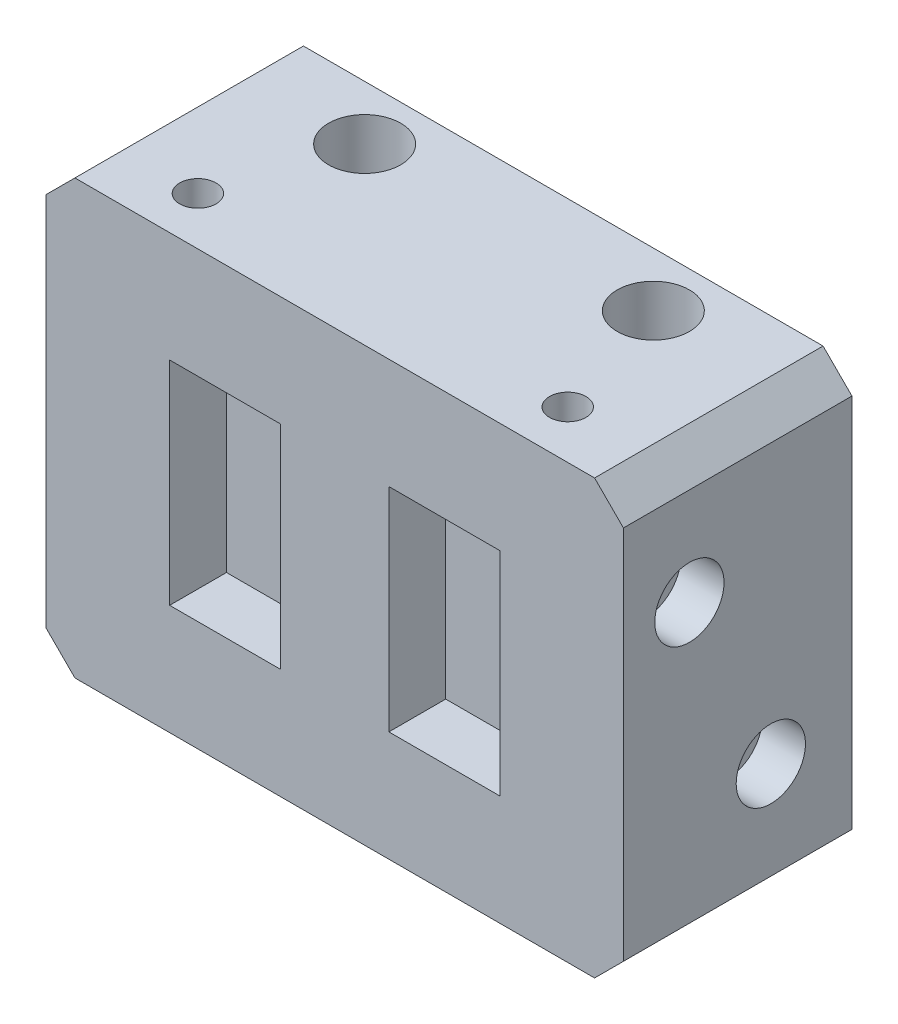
SolidWorks part; units mm, degrees
ref_plane "Plane1" through (0, 0, 0) normal (0, 0, 1) x (1, 0, 0)
ref_plane "Plane2" through (0, 0, 0) normal (0, 1, 0) x (1, 0, 0)
ref_plane "Plane3" through (0, 0, 0) normal (1, 0, 0) x (0, 0, -1)
imported_body "Imported1"
sketch "Sketch1" plane through (0, 0, 19.7208) normal (0, 0, 1) x (1, 0, 0)
  line L0 (-3.44, -0.75) -> (47.36, -0.75)
  line L1 (47.36, -0.75) -> (47.36, 37.35)
  line L2 (47.36, 37.35) -> (-3.44, 37.35)
  line L3 (-3.44, 37.35) -> (-3.44, -0.75)
  line L4 (-3.44, 1.79) -> (-3.44, 34.81) construction
  line L5 (47.36, 34.81) -> (47.36, 1.79) construction
  line L6 (44.82, -0.75) -> (-0.9, -0.75) construction
  line L7 (-0.9, 37.35) -> (44.82, 37.35) construction
extrude "Cut-Extrude1" cut sketch "Sketch1" against normal blind 0.0127
